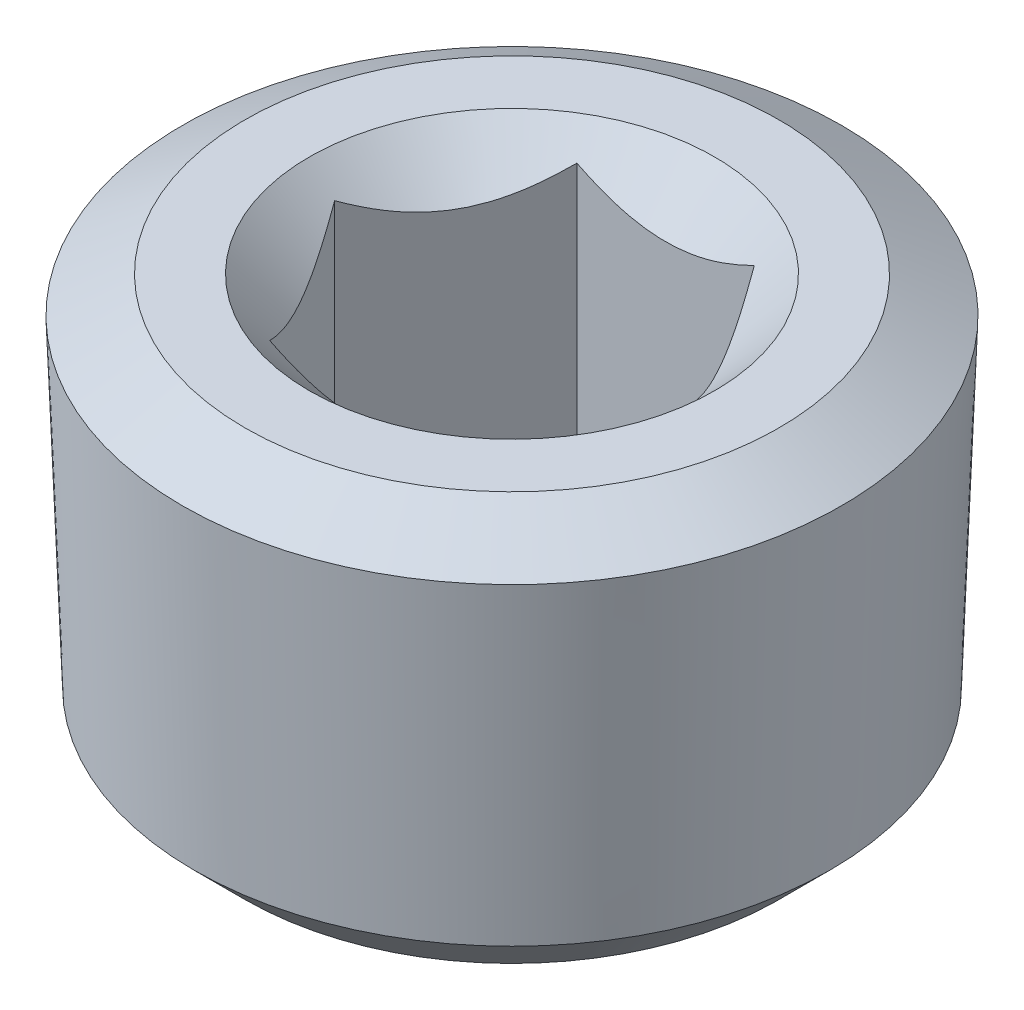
SolidWorks part; units mm, degrees
ref_plane "Front Plane" through (0, 0, 0) normal (0, 0, 1) x (1, 0, 0)
ref_plane "Top Plane" through (0, 0, 0) normal (0, 1, 0) x (1, 0, 0)
ref_plane "Right Plane" through (0, 0, 0) normal (1, 0, 0) x (0, 0, -1)
sketch "Sketch2" plane through (0, 0, 0) normal (0, 0, 1) x (1, 0, 0)
  line L0 (0, 10.7443) -> (0, -17.0657) construction
  line L1 (0, 0) -> (-4.15, 0)
  line L2 (-5.123, -0.5618) -> (-4.9408, -5.5592)
  line L3 (-4.15, -6.35) -> (0, -6.35)
  line L4 (0, -6.35) -> (0, 0)
  line L6 (-4.15, -6.35) -> (-4.9408, -5.5592)
  line L7 (-4.15, 0) -> (-5.123, -0.5618)
  point P4 (-5.1435, 0)
  point P6 (-4.912, -6.35)
  dimension "D1" = 6.35
  dimension "D2" = 2.088
  dimension "D3" = 10.287
  dimension "D4" = 30
  dimension "D5" = 0.762
  dimension "D6" = 45
revolve "Revolve1" add sketch "Sketch2" angle 360 about L0
sketch "Sketch3" plane through (0, 0, 0) normal (0, 0, 1) x (1, 0, 0)
  line L0 (0, 2.9342) -> (0, -8.1202) construction
  line L1 (0, 0) -> (-3.1496, 0)
  line L2 (4.15, 0) -> (-4.15, 0) construction
  line L3 (-2.3876, -0.762) -> (-2.3876, -4.318)
  line L4 (-2.3876, -4.318) -> (-1.1194, -5.08)
  line L5 (0, -5.08) -> (0, 0)
  line L6 (-2.3876, -0.762) -> (-3.1496, 0)
  line L8 (-1.1194, -5.08) -> (0, -5.08)
  dimension "D1" = 4.318
  dimension "D2" = 59
  dimension "D3" = 4.7752
  dimension "D4" = 0.762
  dimension "D5" = 45
  dimension "D6" = 5.08
revolve "Cut-Revolve1" cut sketch "Sketch3" angle 360 about L0
sketch "Sketch4" plane through (0, 0, 0) normal (0, 1, 0) x (1, 0, 0)
  line L1 (-1.3785, -2.3876) -> (1.3785, -2.3876)
  line L2 (1.3785, -2.3876) -> (2.757, 0)
  line L3 (2.757, 0) -> (1.3785, 2.3876)
  line L4 (1.3785, 2.3876) -> (-1.3785, 2.3876)
  line L5 (-1.3785, 2.3876) -> (-2.757, 0)
  line L6 (-2.757, 0) -> (-1.3785, -2.3876)
  circle A0 centre (0, 0) radius 2.3876 construction
  circle A1 centre (0, 0) radius 2.3876 construction
extrude "Cut-Extrude1" cut sketch "Sketch4" against normal up to vertex (5.2929 mm away)
